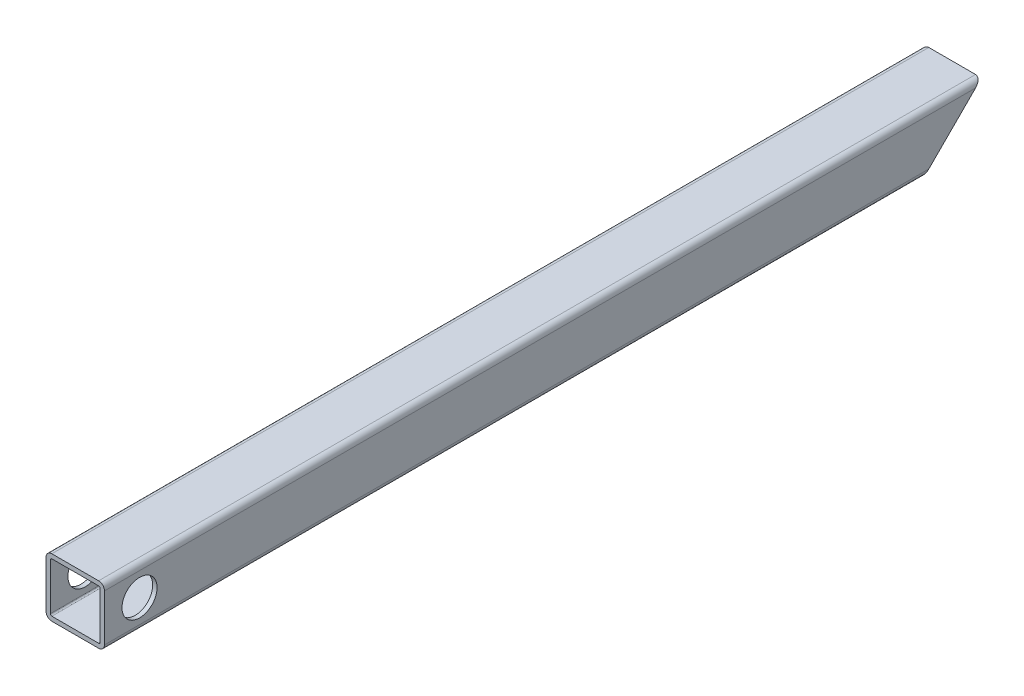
SolidWorks part; units mm, degrees
ref_plane "Plan de face" through (0, 0, 0) normal (0, 0, 1) x (1, 0, 0)
ref_plane "Plan de dessus" through (0, 0, 0) normal (0, 1, 0) x (1, 0, 0)
ref_plane "Plan de droite" through (0, 0, 0) normal (1, 0, 0) x (0, 0, -1)
sketch "Esquisse1" plane through (0, 0, 0) normal (0, 0, 1) x (1, 0, 0)
  line L0 (-8.5, 18.5) -> (8.5, 18.5)
  line L1 (-10, 0) -> (10, 0)
  line L2 (-10, 0) -> (-10, 20)
  line L3 (-10, 20) -> (10, 20)
  line L4 (10, 0) -> (10, 20)
  line L5 (8.5, 1.5) -> (8.5, 18.5)
  line L6 (-8.5, 1.5) -> (8.5, 1.5)
  line L7 (-8.5, 1.5) -> (-8.5, 18.5)
  point P8 (0, 0)
  dimension "D2" = 20
  dimension "D1" = 1.5
extrude "Extrusion1" add sketch "Esquisse1" along normal blind 300
sketch "Esquisse2" plane through (10, 0, 0) normal (1, 0, 0) x (0, 0, -1)
  line L0 (0, 0) -> (0, 1.157)
  line L1 (0, 0) -> (0, 20) construction
  line L2 (0, 20) -> (-20, 0)
  line L3 (-300, 0) -> (0, 0) construction
  line L4 (-20, 0) -> (0, 0)
  dimension "D1" = 45
extrude "Extrusion2" cut sketch "Esquisse2" against normal through all and the other way through all
sketch "Esquisse3" plane through (10, 0, 0) normal (1, 0, 0) x (0, 0, -1)
  line L0 (-300, 18.5) -> (-300, 1.5) construction
  line L1 (-300, 0) -> (-300, 20) construction
  circle A0 centre (-288, 10) radius 6
  point P2 (-300, 10)
  dimension "D1" = 12
  dimension "D2" = 12
extrude "Extrusion3" cut sketch "Esquisse3" against normal through all
fillet "Congé1" radius 2 4 edges at (-10, 0, 160) (10, 0, 160) (-10, 20, 150) (10, 20, 150)
fillet "Congé2" radius 0.5 4 edges at (8.5, 1.5, 159.25) (8.5, 18.5, 150.75) (-8.5, 18.5, 150.75) (-8.5, 1.5, 159.25)
